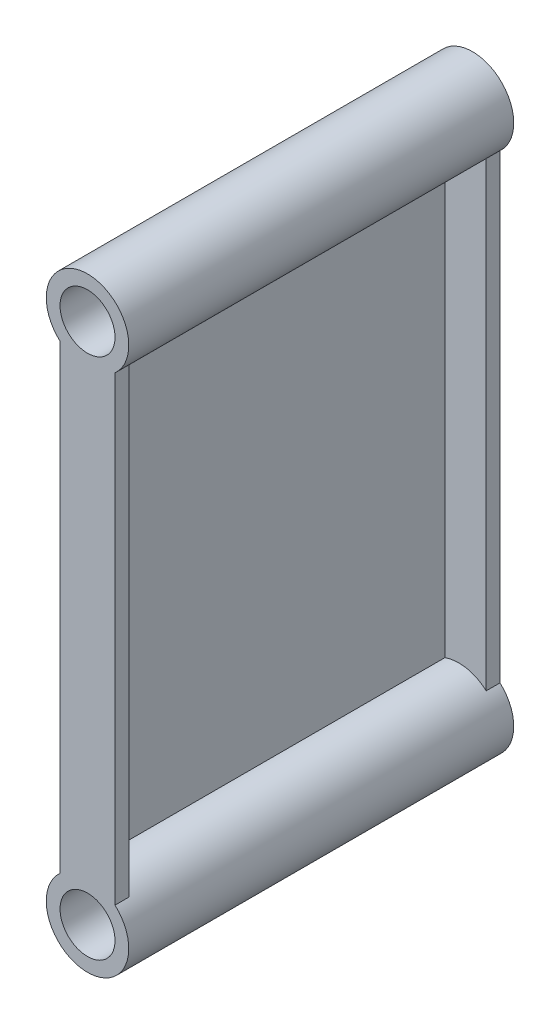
SolidWorks part; units mm, degrees
ref_plane "Vorne" through (0, 0, 0) normal (0, 0, 1) x (1, 0, 0)
ref_plane "Oben" through (0, 0, 0) normal (0, 1, 0) x (1, 0, 0)
ref_plane "Rechts" through (0, 0, 0) normal (1, 0, 0) x (0, 0, -1)
sketch "Skizze1" plane through (0, 0, 0) normal (0, 0, 1) x (1, 0, 0)
  line L0 (-1, 8.382) -> (-1, -8.382)
  line L1 (1, 8.382) -> (1, -8.382)
  arc A0 (1, 8.382) -> (-1, 8.382) centre (0, 9.5) ccw
  arc A1 (-1, -8.382) -> (1, -8.382) centre (0, -9.5) ccw
  dimension "D1" = 3
  dimension "D2" = 3
  dimension "D3" = 19
  dimension "D4" = 9.5
  dimension "D5" = 2
  dimension "D6" = 1
extrude "Linear austragen1" add sketch "Skizze1" along normal blind 14
sketch "Skizze2" plane through (0, 0, 14) normal (0, 0, 1) x (1, 0, 0)
  circle A0 centre (0, 9.5) radius 1
  circle A1 centre (0, -9.5) radius 1
  dimension "D1" = 2
  dimension "D2" = 2
extrude "Linear austragen2" cut sketch "Skizze2" against normal through all
sketch "Skizze3" [suppressed] plane through (0, 0, 0) normal (0, 0, 1) x (1, 0, 0)
  line L0 (-10.9971, 10.938) -> (-8.1934, 9.2309)
  line L1 (-8.1934, 9.2309) -> (-1.0911, 1.1294)
  line L2 (-1.0911, 1.1294) -> (-1.0911, 1.0294)
  line L4 (0.4749, 1.4228) -> (-7.2685, 10.2555)
  line L5 (-7.2685, 10.2555) -> (-10.9723, 13.2812)
  arc A0 (-10.9723, 13.2812) -> (-10.9971, 10.938) centre (-11.9213, 12.1195) ccw
  arc A1 (-1.0911, 1.0294) -> (0.4749, 1.4228) centre (0, 0) ccw
  dimension "D1" = 3
  dimension "D2" = 3
  dimension "D3" = 17
  dimension "D4" = 11.9213
  dimension "D5" = 1.371
  dimension "D6" = 7.908
  dimension "D7" = 0.1
  dimension "D9" = 4.7826
  dimension "D10" = 11.7463
  dimension "D11" = 3.2825
extrude "Linear austragen3" [suppressed] add sketch "Skizze3" along normal blind 13
sketch "Skizze4" [suppressed] plane through (0, 0, 13) normal (0, 0, 1) x (1, 0, 0)
  circle A0 centre (0, 0) radius 1
  circle A1 centre (-11.9213, 12.1195) radius 1
  dimension "D1" = 2
  dimension "D2" = 2
extrude "Linear austragen4" [suppressed] cut sketch "Skizze4" against normal through all
shell "Wandung2" thickness 0.5
